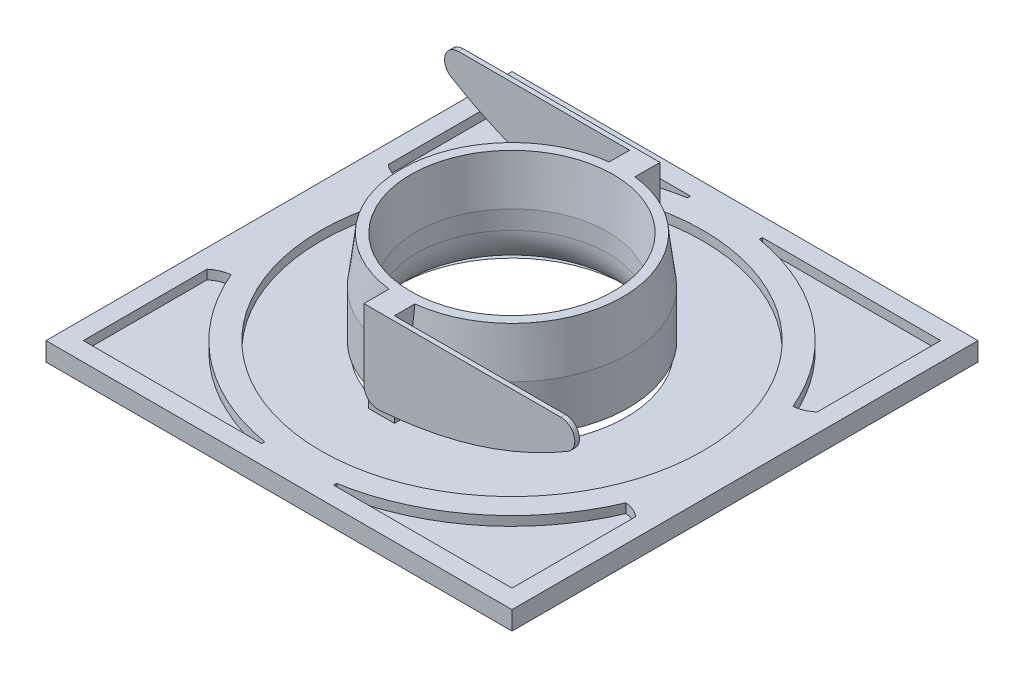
SolidWorks part; units mm, degrees
ref_plane "Alzado" through (0, 0, 0) normal (0, 0, 1) x (1, 0, 0)
ref_plane "Planta" through (0, 0, 0) normal (0, 1, 0) x (1, 0, 0)
ref_plane "Vista lateral" through (0, 0, 0) normal (1, 0, 0) x (0, 0, -1)
sketch "Croquis1" plane through (0, 0, 0) normal (0, 1, 0) x (1, 0, 0)
  line L1 (-50, 50) -> (50, 50)
  line L2 (-50, 50) -> (-50, -50)
  line L3 (-50, -50) -> (50, -50)
  line L4 (50, 50) -> (50, -50)
  line L5 (-50, 50) -> (50, -50) construction
  line L6 (-50, -50) -> (50, 50) construction
  point P0 (0, 0)
  dimension "D1" = 100
  dimension "D2" = 100
extrude "Saliente-Extruir1" add sketch "Croquis1" along normal blind 4
sketch "Croquis2" plane through (0, 0, 0) normal (0, -1, 0) x (1, 0, 0)
  circle A0 centre (0, 0) radius 42.5
  circle A1 centre (0, 0) radius 41.5
  dimension "D1" = 85
  dimension "D2" = 1
extrude "Cortar-Extruir1" cut sketch "Croquis2" against normal blind 2
sketch "Croquis3" plane through (0, 0, 0) normal (0, -1, 0) x (1, 0, 0)
  circle A0 centre (0, 0) radius 20.5
  dimension "D1" = 41
extrude "Cortar-Extruir2" cut sketch "Croquis3" against normal through all
sketch "Croquis4" plane through (0, 4, 0) normal (0, 1, 0) x (1, 0, 0)
  circle A0 centre (0, 0) radius 20.5
  circle A1 centre (0, 0) radius 25
  dimension "D1" = 50
extrude "Saliente-Extruir2" add sketch "Croquis4" along normal blind 10
sketch "Croquis5" plane through (0, 14, 0) normal (0, 1, 0) x (1, 0, 0)
  circle A0 centre (0, 0) radius 20.5 construction
  circle A1 centre (0, 0) radius 25
  circle A2 centre (0, 0) radius 25
  circle A3 centre (0, 0) radius 20.5
  dimension "D1" = 0
extrude "Saliente-Extruir3" add sketch "Croquis5" along normal blind 10 draft 7
fillet "Redondeo1" radius 10 1 edges at (0, 0, -20.5)
ref_plane "Plano1" through (0, 0, 28) normal (0, 0, 1) x (1, 0, 0)
sketch "Croquis7" plane through (0, 0, 28) normal (0, 0, 1) x (1, 0, 0)
  line L0 (25, 14) -> (-25, 14) construction
  line L1 (2.7638, 4) -> (-2.7638, 4)
  line L2 (2.7638, 4) -> (2.7638, 24)
  line L3 (2.7638, 24) -> (-2.7638, 24)
  line L4 (-2.7638, 4) -> (-2.7638, 24)
  line L5 (2.7638, 4) -> (-2.7638, 24) construction
  line L6 (2.7638, 24) -> (-2.7638, 4) construction
  line L7 (21.7278, 24) -> (-21.7278, 24) construction
  point P0 (0, 14)
extrude "Saliente-Extruir4" add sketch "Croquis7" against normal up to next
sketch "Croquis8" plane through (0, 0, 28) normal (0, 0, 1) x (1, 0, 0)
  line L1 (-2.7638, 24) -> (39.4738, 24)
  line L2 (-2.7638, 24) -> (-2.7638, 8.824)
  arc A0 (0.4585, 5.8322) -> (-2.7638, 8.824) centre (0.2362, 8.824) cw
  arc A1 (41.0026, 18.4188) -> (39.4738, 24) centre (39.4738, 21) ccw
  spline S0 degree 3 poles (0.4585, 5.8322) (10.718, 6.5946) (24.5031, 9.8177) (37.2907, 16.2203) (41.0026, 18.4188) knots 0.055671 0.055671 0.055671 0.055671 0.590547 0.821789 0.821789 0.821789 0.821789
  dimension "D1" = 3
extrude "Saliente-Extruir5" add sketch "Croquis8" along normal blind 1
pattern_circular "MatrizC1" count 2 over 360 about axis through (0, 24, 0) along (0, 1, 0) of "Saliente-Extruir4", "Saliente-Extruir5"
sketch "Croquis11" plane through (0, 4, 0) normal (0, 1, 0) x (1, 0, 0)
  line L4 (-13.2, 0) -> (13.2, 0) construction
  line L5 (0, -13.2) -> (0, 13.2) construction
  line L6 (-7.7929, 46) -> (-46, 46)
  line L7 (46, 19.4504) -> (46, 46)
  line L8 (46, -46) -> (46, 46)
  line L9 (46, 46) -> (-46, 46)
  line L10 (-46, 46) -> (-46, -46)
  line L11 (-46, -46) -> (46, -46)
  line L12 (46, -46) -> (46, -19.4504)
  line L13 (46, 46) -> (7.7929, 46)
  line L14 (-46, 46) -> (-46, 19.4504)
  line L15 (-46, -46) -> (-7.7929, -46)
  line L16 (-46, -19.4504) -> (-46, -46)
  line L17 (7.7929, -46) -> (46, -46)
  arc A0 (42.3682, 17.9147) -> (7.7929, 45.3351) centre (0, 0) ccw
  circle A1 centre (0, 0) radius 41
  arc A2 (-46, 19.4504) -> (-42.3682, 17.9147) centre (-41.7465, 24.4474) ccw
  arc A3 (-46, -19.4504) -> (-42.3682, -17.9147) centre (-41.7465, -24.4474) cw
  arc A4 (46, -19.4504) -> (42.3682, -17.9147) centre (41.7465, -24.4474) ccw
  arc A5 (46, 19.4504) -> (42.3682, 17.9147) centre (41.7465, 24.4474) cw
  circle A6 centre (0, 0) radius 46 construction
  arc A7 (-42.3682, -17.9147) -> (-7.7929, -45.3351) centre (0, 0) ccw
  arc A8 (-7.7929, 45.3351) -> (-7.7929, 46) centre (-8.2314, 45.6675) ccw
  arc A9 (7.7929, 45.3351) -> (7.7929, 46) centre (8.2314, 45.6675) cw
  arc A10 (7.7929, -45.3351) -> (7.7929, -46) centre (8.2314, -45.6675) ccw
  arc A11 (-7.7929, -45.3351) -> (-7.7929, -46) centre (-8.2314, -45.6675) cw
  arc A12 (7.7929, -45.3351) -> (42.3682, -17.9147) centre (0, 0) ccw
  arc A13 (-7.7929, 45.3351) -> (-42.3682, 17.9147) centre (0, 0) ccw
  dimension "D1" = 4
  dimension "D2" = 5
extrude "Cortar-Extruir4" cut sketch "Croquis11" against normal blind 2
